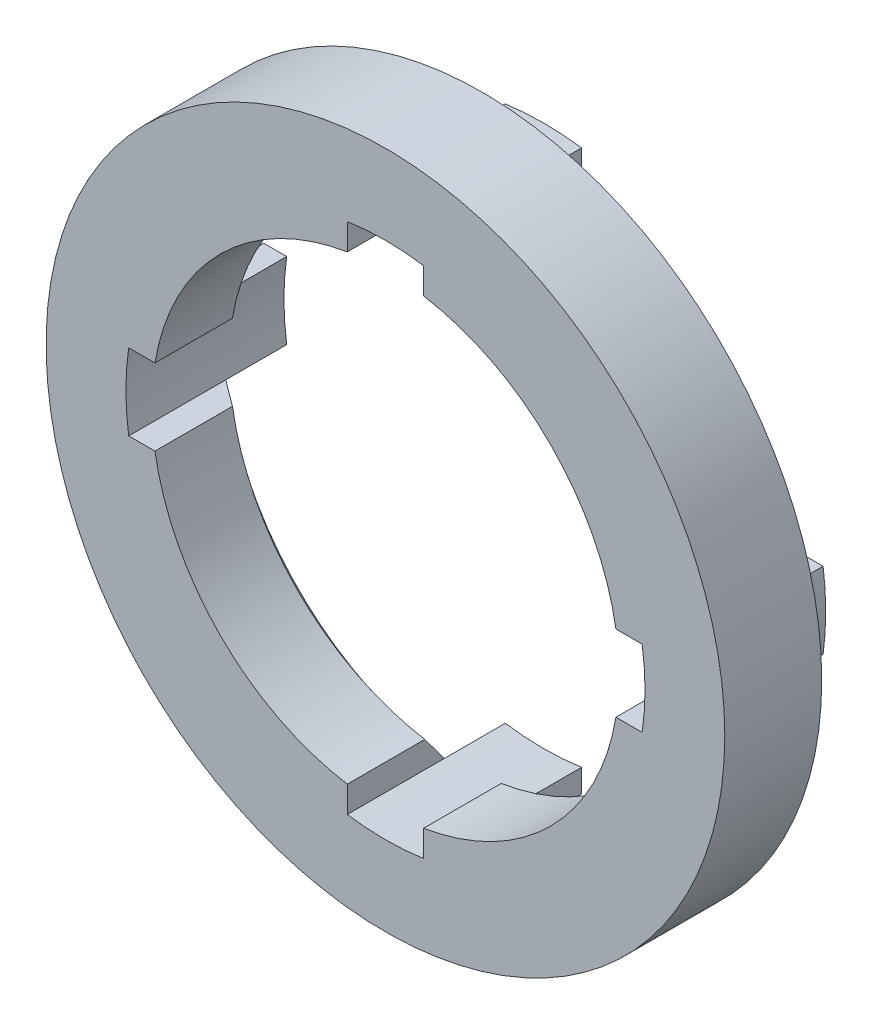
SolidWorks part; units mm, degrees
ref_plane "Front Plane" through (0, 0, 0) normal (0, 0, 1) x (1, 0, 0)
ref_plane "Top Plane" through (0, 0, 0) normal (0, 1, 0) x (1, 0, 0)
ref_plane "Right Plane" through (0, 0, 0) normal (1, 0, 0) x (0, 0, -1)
sketch "Sketch1" plane through (0, 0, 0) normal (0, 0, 1) x (1, 0, 0)
  circle A0 centre (0, 0) radius 22.225
  dimension "D1" = 44.45
extrude "Boss-Extrude1" add sketch "Sketch1" along normal blind 6.35
sketch "Sketch2" plane through (0, 0, 6.35) normal (0, 0, 1) x (1, 0, 0)
  circle A0 centre (0, 0) radius 15.3
  dimension "D1" = 30.6
extrude "Cut-Extrude1" cut sketch "Sketch2" against normal up to next
sketch "Sketch3" plane through (0, 0, 0) normal (0, 1, 0) x (1, 0, 0)
  line L0 (0, 0) -> (0, -6.35) construction
  line L1 (-15.3, -6.35) -> (15.3, -6.35) construction
  line L2 (-16, 0) -> (-16, -6.35) construction
  line L3 (22.225, 0) -> (-22.225, 0) construction
  line L4 (-22.225, -6.35) -> (22.225, -6.35) construction
  line L5 (-15, -1.4989) -> (-17, 0)
  line L6 (-17, 0) -> (-15, 0)
  line L7 (15.3, 0) -> (-15.3, 0) construction
  line L8 (-15, 0) -> (-15, -1.4989)
  dimension "D1" = 16
  dimension "D2" = 15
  dimension "D3" = 17
  dimension "D4" = 53.15
revolve "Cut-Revolve1" cut sketch "Sketch3" angle 360 about L0
sketch "Sketch4" plane through (0, 0, 6.35) normal (0, 0, 1) x (1, 0, 0)
  line L0 (0, 0) -> (-50000, 0) construction
  line L1 (-16.8152, 2.5) -> (-15.0944, 2.5)
  line L2 (-16.8152, -2.5) -> (-15.0944, -2.5)
  line L3 (-15.0944, -2.5) -> (-15.0944, 2.5)
  arc A0 (-16.8152, 2.5) -> (-16.8152, -2.5) centre (0, 0) ccw
  circle A1 centre (0, 0) radius 15.3 construction
  dimension "D1" = 5
  dimension "D2" = 17
extrude "Cut-Extrude2" cut sketch "Sketch4" against normal up to next
sketch "Sketch5" plane through (0, 0, 0) normal (0, 0, -1) x (-1, 0, 0)
  line L0 (0, 0) -> (-50000, 0) construction
  line L1 (-16.8152, 2.5) -> (-18.3152, 2.5)
  line L2 (-16.8152, -2.5) -> (-18.3152, -2.5)
  arc A0 (-16.8152, 2.5) -> (-16.8152, -2.5) centre (0, 0) ccw
  arc A1 (-18.3152, 2.5) -> (-18.3152, -2.5) centre (0, 0) ccw
  dimension "D1" = 5
  dimension "D2" = 17
  dimension "D3" = 1.5
extrude "Boss-Extrude2" add sketch "Sketch5" along normal blind 4
pattern_circular "CirPattern1" count 4 over 360 about axis through (0, 0, 0) along (0, 0, 1) of "Cut-Extrude2", "Boss-Extrude2"
